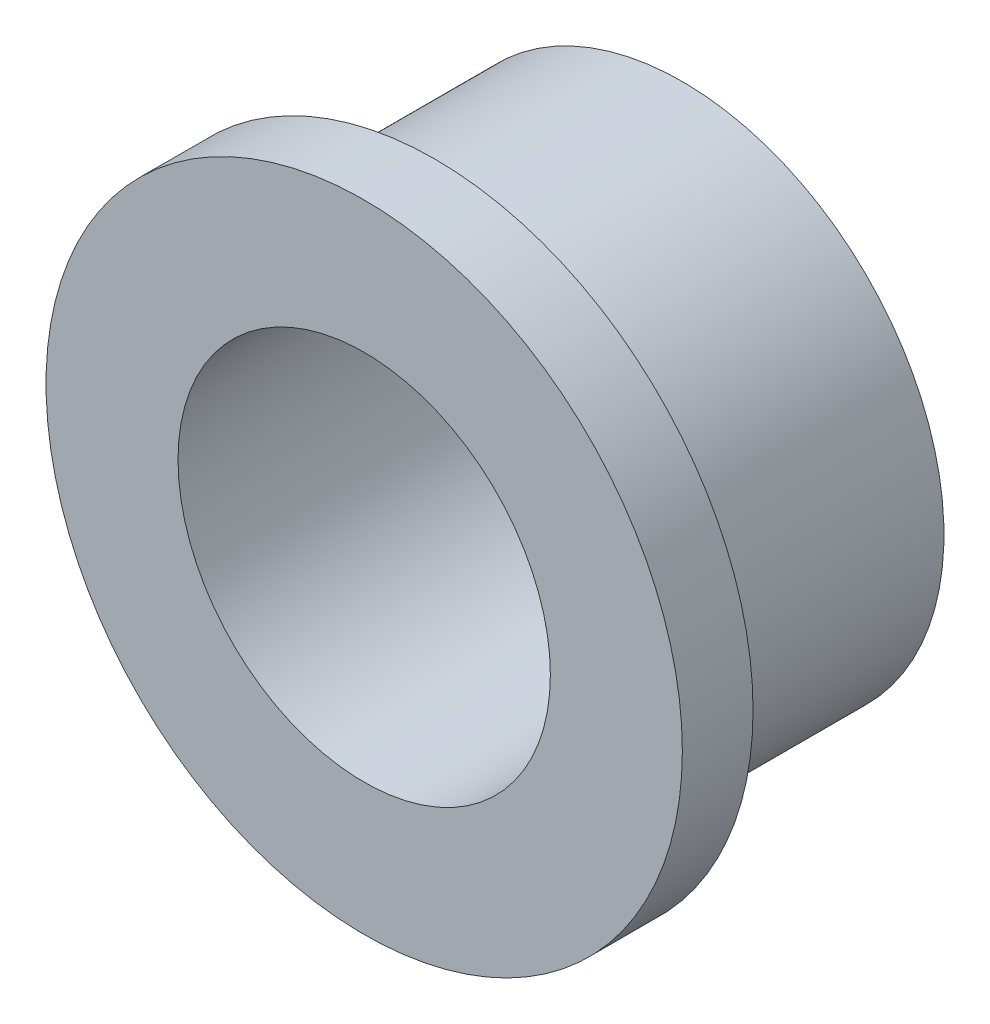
SolidWorks part; units mm, degrees
ref_plane "正面" through (0, 0, 0) normal (0, 0, 1) x (1, 0, 0)
ref_plane "平面" through (0, 0, 0) normal (0, 1, 0) x (1, 0, 0)
ref_plane "右側面" through (0, 0, 0) normal (1, 0, 0) x (0, 0, -1)
sketch "ｽｹｯﾁ1" plane through (0, 0, 0) normal (0, 0, 1) x (1, 0, 0)
  circle A0 centre (0, 0) radius 13.5
  dimension "D1" = 27
extrude "ﾎﾞｽ - 押し出し1" add sketch "ｽｹｯﾁ1" against normal blind 13.5
sketch "ｽｹｯﾁ2" plane through (0, 0, 0) normal (0, 0, 1) x (1, 0, 0)
  circle A0 centre (0, 0) radius 7.9
  dimension "D1" = 15.8
extrude "ｶｯﾄ - 押し出し1" cut sketch "ｽｹｯﾁ2" against normal through all
sketch "ｽｹｯﾁ3" plane through (0, 0, -13.5) normal (0, 0, -1) x (-1, 0, 0)
  circle A0 centre (0, 0) radius 11.1
  dimension "D1" = 22.2
extrude "ｶｯﾄ - 押し出し2" cut sketch "ｽｹｯﾁ3" against normal blind 10.5 flip side to cut
chamfer "面取り1" distance 1 angle 45 1 edges at (7.9, 0, -13.5)
